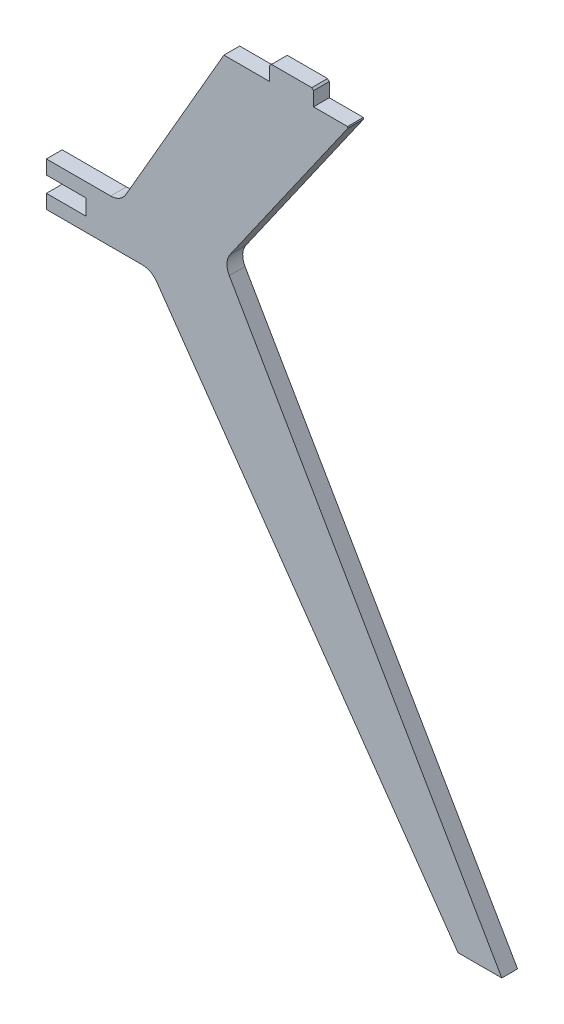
SolidWorks part; units mm, degrees
ref_plane "Alzado" through (0, 0, 0) normal (0, 0, 1) x (1, 0, 0)
ref_plane "Planta" through (0, 0, 0) normal (0, 1, 0) x (1, 0, 0)
ref_plane "Vista lateral" through (0, 0, 0) normal (1, 0, 0) x (0, 0, -1)
sketch "Croquis1" plane through (0, 0, 0) normal (0, 0, 1) x (1, 0, 0)
  line L0 (0, 0) -> (-317.5426, 550)
  line L4 (-400.1038, 500) -> (-50, 0)
  line L5 (-50, 0) -> (0, 0)
  line L6 (-400.1038, 500) -> (-520, 500)
  line L7 (-520, 550) -> (-520, 500) construction
  line L8 (-520, 550) -> (-435.1141, 550)
  line L9 (-435.1141, 550) -> (-317.3347, 754)
  line L10 (-400.1038, 500) -> (-435.1141, 550) construction
  line L11 (-520, 550) -> (-520, 534)
  line L12 (-520, 534) -> (-475, 534)
  line L13 (-475, 534) -> (-475, 516)
  line L14 (-475, 516) -> (-520, 516)
  line L15 (-520, 516) -> (-520, 500)
  line L16 (-475, 525) -> (-520, 525) construction
  line L17 (-317.5426, 550) -> (-174.7003, 754)
  line L18 (-317.3347, 754) -> (-174.7003, 754)
  line L19 (-435.1141, 550) -> (-317.5426, 550) construction
  dimension "D5" = 45
  dimension "D1" = 50
  dimension "D2" = 60
  dimension "D3" = 55
  dimension "D4" = 18
  dimension "D6" = 50
  dimension "D7" = 500
  dimension "D8" = 520
  dimension "D9" = 60
  dimension "D10" = 55
  dimension "D11" = 754
extrude "Saliente-Extruir1" add sketch "Croquis1" along normal blind 18
sketch "Croquis2" plane through (0, 754, 0) normal (0, 1, 0) x (1, 0, 0)
  line L0 (-265, -18) -> (-215, -18)
  line L1 (-174.7003, -18) -> (-317.3347, -18) construction
  line L2 (-265, -18) -> (-265, -6) construction
  line L3 (-215, -18) -> (-215, 0)
  line L4 (-174.7003, 0) -> (-317.3347, 0) construction
  line L5 (-215, -6) -> (-215, -18) construction
  line L6 (-215, 0) -> (-265, 0)
  line L7 (-265, 0) -> (-265, -18)
extrude "Saliente-Extruir2" add sketch "Croquis2" along normal blind 18
chamfer "Chaflán1" distance 2 angle 45 3 edges at (-174.7003, 754, 9) (-265, 772, 9) (-215, 772, 9)
fillet "Redondeo1" radius 20 3 edges at (-317.5426, 550, 9) (-400.1038, 500, 9) (-435.1141, 550, 9)
